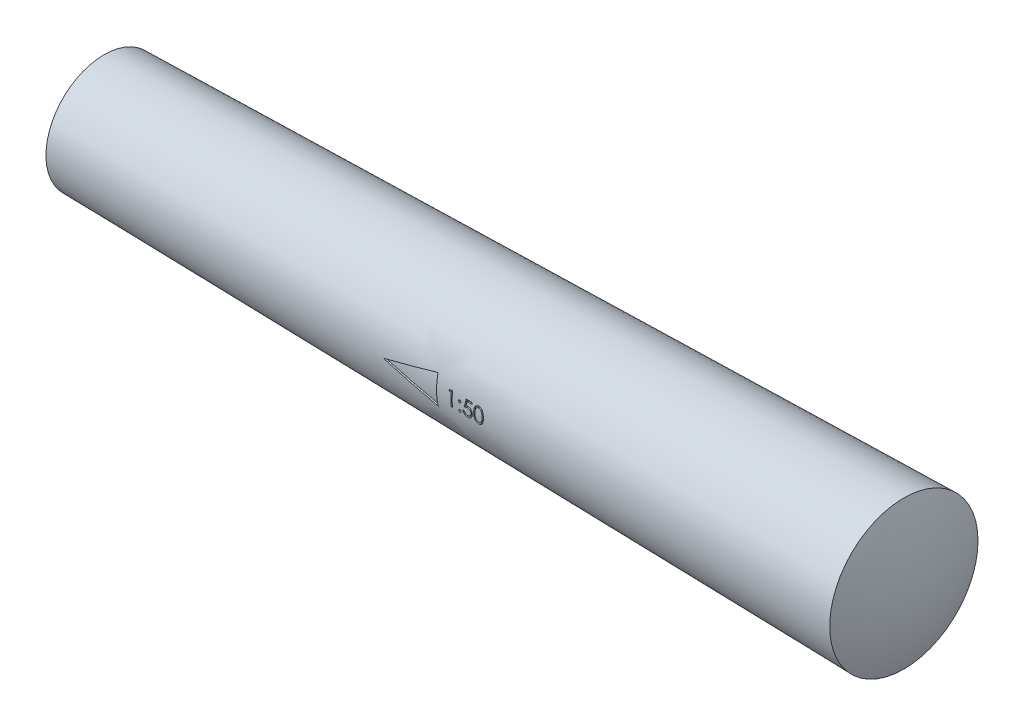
SolidWorks part; units mm, degrees
ref_plane "Front Plane" through (0, 0, 0) normal (0, 0, 1) x (1, 0, 0)
ref_plane "Top Plane" through (0, 0, 0) normal (0, 1, 0) x (1, 0, 0)
ref_plane "Right Plane" through (0, 0, 0) normal (1, 0, 0) x (0, 0, -1)
sketch "Sketch1" plane through (0, 0, 0) normal (1, 0, 0) x (0, 0, -1)
  circle A0 centre (0, 0) radius 4
  dimension "D1" = 8
extrude "Extrude1" add sketch "Sketch1" along normal mid plane 55
draft "Draft1" type of draft neutral plane draft angle 1.146 faces to draft 1 parameters "D1"=1.146
sketch "Sketch2" plane through (0, 0, 0) normal (0, 0, 1) x (1, 0, 0)
  line L0 (-27.5, 0) -> (-27.5, 4)
  line L1 (-27.5, 4) -> (-27.5, -4) construction
  line L2 (-27.5, 0) -> (-28.5, 0)
  line L3 (-28.5, 0) -> (-28.5, -4.55) construction
  line L4 (27.5, 0) -> (27.5, 5.1)
  line L5 (27.5, -5.1) -> (27.5, 5.1) construction
  line L6 (27.5, 0) -> (28.5, 0)
  line L7 (28.5, 0) -> (28.5, -4.55) construction
  line L8 (-27.5, -4) -> (27.5, -5.1) construction
  arc A0 (-28.5, 0) -> (-27.5, 4) centre (-20, 0) cw
  arc A1 (28.5, 0) -> (27.5, 5.1) centre (14.9948, 0) ccw
  point P14 (0, -4.55)
revolve "Revolve1" add sketch "Sketch2" angle 360 about L2
sketch "Sketch5" plane through (0, 0, 0) normal (0, 0, 1) x (1, 0, 0)
  line L0 (0, 4.55) -> (0, -4.55) construction
  line L1 (27.5, 5.1) -> (-27.5, 4) construction
  line L2 (-27.5, -4) -> (27.5, -5.1) construction
ref_plane "Plane2" through (0, 0, 0) normal (-0.02, 0, 0.9998) x (0.9998, 0, 0.02)
sketch "Sketch6" plane through (0, 0, 0) normal (-0.02, 0, 0.9998) x (0.9998, 0, 0.02)
  line L0 (0, 0) -> (0, 1)
  line L1 (0, 4.55) -> (0, -4.55) construction
  line L2 (0, 1) -> (-3.7321, 0)
  line L3 (-3.7321, 0) -> (0, -1)
  line L4 (0, -1) -> (0, 0)
  line L5 (0, -0.5) -> (4, -0.5) construction
  text T0 "1:50" font "Century Gothic" height 1
  dimension "D1" = 2
  dimension "D2" = 30
  dimension "D3" = 4
wrap "Wrap2" sketch "Sketch6" wrap type deboss source sketch "Sketch6" thickness 0.1 parameters "D1"=0.1
equation "\"D2@Sketch2\" = \"D1@Sketch2\""
